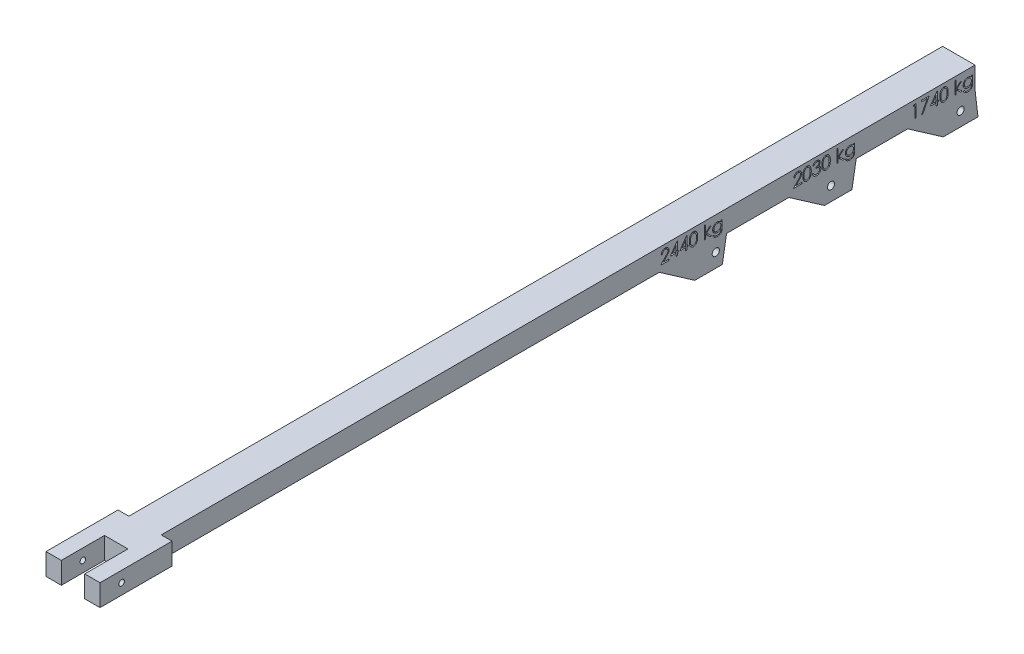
SolidWorks part; units mm, degrees
ref_plane "Front Plane" through (0, 0, 0) normal (0, 0, 1) x (1, 0, 0)
ref_plane "Top Plane" through (0, 0, 0) normal (0, 1, 0) x (1, 0, 0)
ref_plane "Right Plane" through (0, 0, 0) normal (1, 0, 0) x (0, 0, -1)
sketch "Sketch1" plane through (0, 0, 0) normal (1, 0, 0) x (0, 0, -1)
  line L0 (-300, 0) -> (12000, 0) construction
  line L1 (-300, 150) -> (12000, 150)
  line L2 (-300, 150) -> (-300, -150)
  line L3 (-300, -150) -> (7614.8275, -150)
  line L4 (12000, 150) -> (12000, -150)
  line L5 (12000, -150) -> (12040.8394, -493.8215)
  line L6 (12040.8394, -493.8215) -> (11559.1606, -493.8215)
  line L7 (11559.1606, -493.8215) -> (11064.8275, -150)
  line L8 (11800, -493.8215) -> (11800, 150) construction
  line L9 (9909.1606, -493.8215) -> (9414.8275, -150)
  line L10 (10290.8394, -493.8215) -> (9909.1606, -493.8215)
  line L11 (10350, -150) -> (10290.8394, -493.8215)
  line L12 (8490.8394, -493.8215) -> (8109.1606, -493.8215)
  line L13 (8550, -150) -> (8490.8394, -493.8215)
  line L14 (8109.1606, -493.8215) -> (7614.8275, -150)
  line L15 (8550, -150) -> (9414.8275, -150)
  line L16 (10350, -150) -> (11064.8275, -150)
  circle A0 centre (0, 0) radius 38.8449
  circle A1 centre (11800, -300) radius 50
  circle A2 centre (10000, -300) radius 50
  circle A3 centre (8400, -300) radius 50
  dimension "D1" = 200
  dimension "D3" = 12000
  dimension "D4" = 100
  dimension "D6" = 300
  dimension "D7" = 10000
  dimension "D8" = 8400
  dimension "D2" = 300
  dimension "D5" = 300
extrude "Boss-Extrude1" add sketch "Sketch1" along normal mid plane 750
sketch "Sketch2" plane through (0, 150, 0) normal (0, 1, 0) x (1, 0, 0)
  line L0 (375, -300) -> (-375, -300) construction
  line L1 (-162.5, -300) -> (162.5, -300)
  line L2 (-162.5, -300) -> (-162.5, 300)
  line L3 (-162.5, 300) -> (162.5, 300)
  line L4 (162.5, -300) -> (162.5, 300)
  line L5 (0, 300) -> (0, -300) construction
  line L6 (375, 12000) -> (375, -300) construction
  line L7 (375, 700) -> (225, 700)
  line L8 (375, 700) -> (375, 12623.1758)
  line L9 (375, 12623.1758) -> (225, 12623.1758)
  line L10 (225, 700) -> (225, 12623.1758)
  line L11 (-375, 700) -> (-225, 700)
  line L12 (-225, 700) -> (-225, 12623.1758)
  line L13 (-375, 12623.1758) -> (-225, 12623.1758)
  line L14 (-375, 700) -> (-375, 12623.1758)
  dimension "D1" = 325
  dimension "D2" = 600
  dimension "D3" = 150
  dimension "D4" = 400
extrude "Cut-Extrude4" cut sketch "Sketch2" against normal blind 700
sketch "Sketch3" plane through (225, 0, 0) normal (1, 0, 0) x (0, 0, -1)
  line L0 (7629.0073, -75) -> (8537.4496, -75) construction
  line L1 (12000, 150) -> (700, 150) construction
  line L2 (9470.1818, -75) -> (10286.3225, -75) construction
  line L4 (11107.3212, -75) -> (11908.8879, -75) construction
  text T0 "2440 kg" font "Century Gothic" height in points 650
  text T1 "2030 kg" font "Century Gothic" height in points 650
  text T2 "1740 kg" font "Century Gothic" height in points 650
  dimension "D1" = 225
extrude "Cut-Extrude5" cut sketch "Sketch3" against normal blind 50
sketch "Sketch4" plane through (225, 0, 0) normal (1, 0, 0) x (0, 0, -1)
  line L1 (12239.5337, 255.5403) -> (8556.6361, 255.5403)
  line L2 (12239.5337, 255.5403) -> (12239.5337, -780.5621)
  line L3 (12239.5337, -780.5621) -> (8556.6361, -780.5621)
  line L4 (8556.6361, 255.5403) -> (8556.6361, -780.5621)
extrude "Cut-Extrude6" [suppressed] cut sketch "Sketch4" against normal through all
